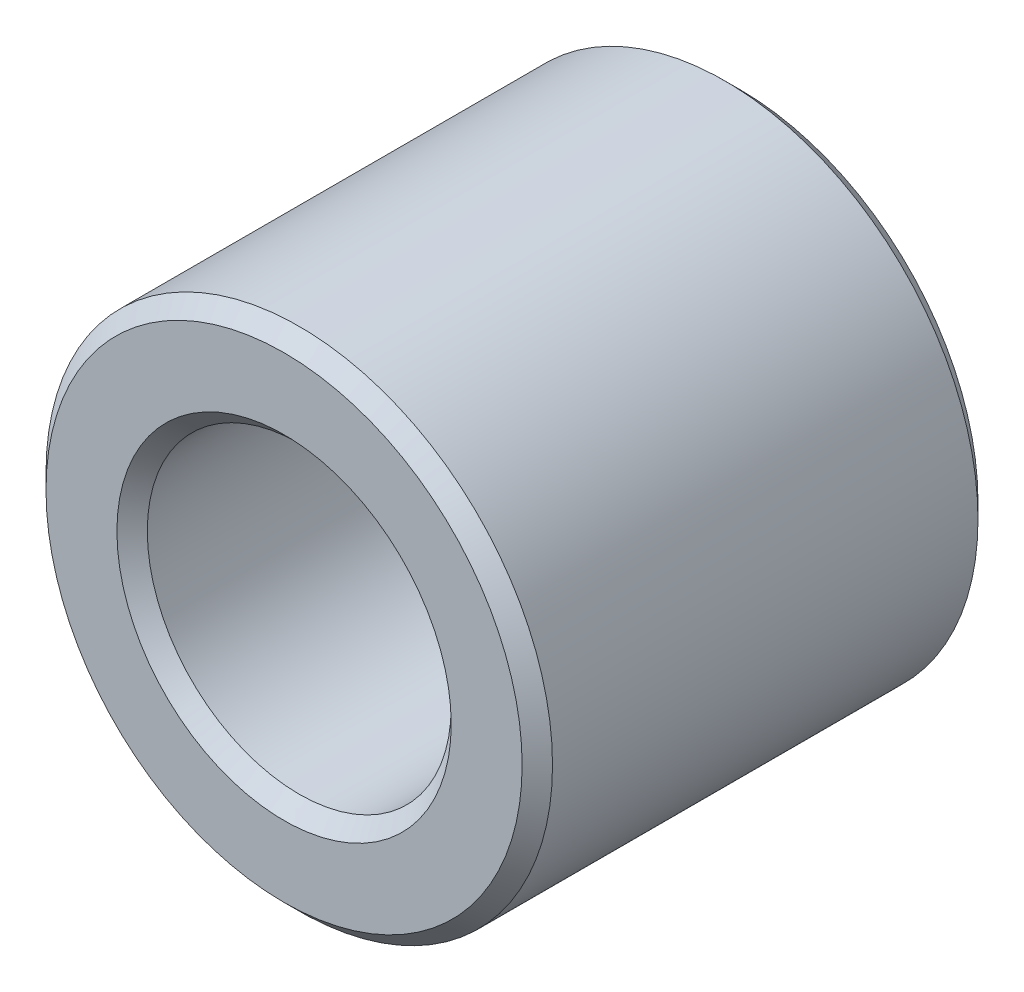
SolidWorks part; units mm, degrees
ref_plane "Front Plane" through (0, 0, 0) normal (0, 0, 1) x (1, 0, 0)
ref_plane "Top Plane" through (0, 0, 0) normal (0, 1, 0) x (1, 0, 0)
ref_plane "Right Plane" through (0, 0, 0) normal (1, 0, 0) x (0, 0, -1)
sketch "Sketch1" plane through (0, 0, 0) normal (0, 0, 1) x (1, 0, 0)
  circle A0 centre (0, 0) radius 30
  circle A1 centre (0, 0) radius 50
  dimension "D1" = 60
  dimension "D2" = 100
extrude "Boss-Extrude1" add sketch "Sketch1" along normal mid plane 90
chamfer "Chamfer1" distance 3 angle 45 4 edges at (30, 0, -45) (50, 0, -45) (30, 0, 45) (50, 0, 45)
